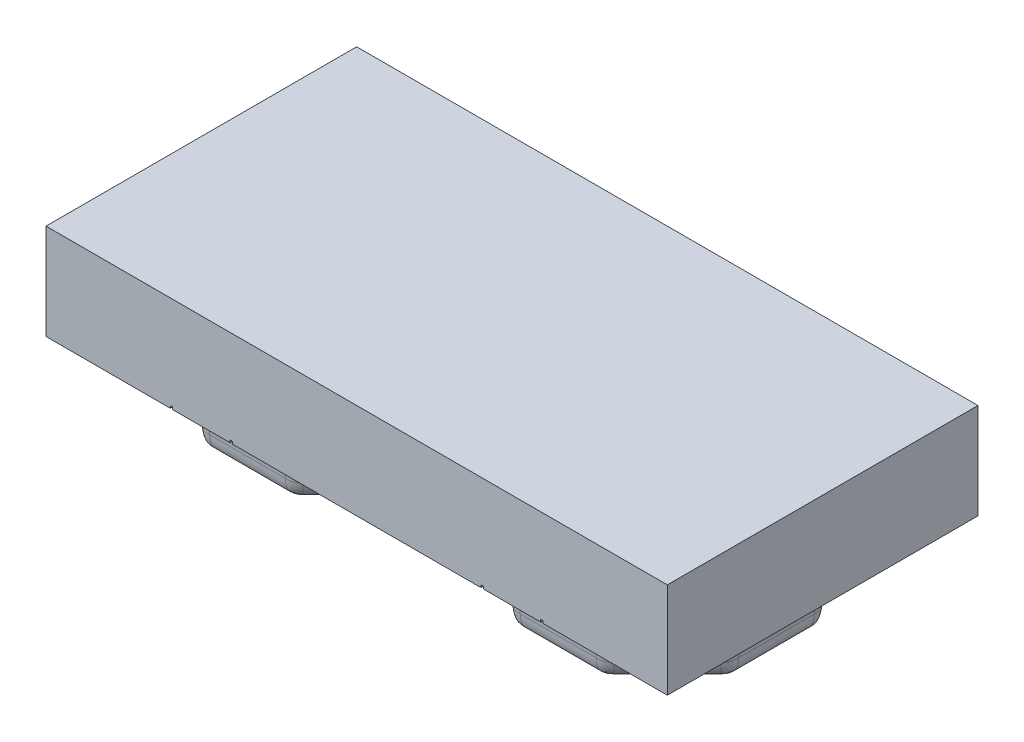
SolidWorks part; units mm, degrees
ref_plane "Front Plane" through (0, 0, 0) normal (0, 0, 1) x (1, 0, 0)
ref_plane "Top Plane" through (0, 0, 0) normal (0, 1, 0) x (1, 0, 0)
ref_plane "Right Plane" through (0, 0, 0) normal (1, 0, 0) x (0, 0, -1)
imported_body "Stock-04_02BowlTEST-1"
sketch "Sketch1" plane through (0, 0, -65) normal (0, 0, -1) x (-1, 0, 0)
  line L5 (-16.5764, 0) -> (16.5765, 0) construction
  line L6 (13, 0) -> (12, 0)
  line L7 (13, 0) -> (13, 1)
  line L8 (13, 1) -> (12, 1)
  line L9 (12, 0) -> (12, 1)
  line L11 (-13, 0) -> (-12, 0)
  line L12 (-13, 0) -> (-13, 1)
  line L13 (-13, 1) -> (-12, 1)
  line L14 (-12, 0) -> (-12, 1)
  dimension "D1" = 12
  dimension "D2" = 12
  dimension "D3" = 1
sketch "Sketch2" plane through (0, 0, 65) normal (0, 0, 1) x (1, 0, 0)
  line L4 (12, 0) -> (13, 0)
  line L5 (12, 1) -> (12, 0)
  line L6 (13, 1) -> (12, 1)
  line L7 (13, 0) -> (13, 1)
  line L8 (12, 0) -> (13, 0)
  line L9 (12, 1) -> (12, 0)
  line L10 (13, 1) -> (12, 1)
  line L11 (13, 0) -> (13, 1)
  line L12 (-13, 0) -> (-12, 0)
  line L13 (-12, 0) -> (-12, 1)
  line L14 (-12, 1) -> (-13, 1)
  line L15 (-13, 1) -> (-13, 0)
  line L16 (-13, 0) -> (-12, 0)
  line L17 (-12, 0) -> (-12, 1)
  line L18 (-12, 1) -> (-13, 1)
  line L19 (-13, 1) -> (-13, 0)
  dimension "D1" = 0
  dimension "D2" = 0
extrude "Cut-Extrude1" cut sketch "Sketch1" against normal up to surface (17.5095 mm away)
extrude "Cut-Extrude2" cut sketch "Sketch2" against normal up to surface (17.5095 mm away)
mirror "Mirror1" about plane through (65, 40, 65) normal (-1, 0, 0)
sketch "Sketch3" plane through (0, 0, 0) normal (0, 1, 0) x (1, 0, 0)
  line L0 (195, 65) -> (171.2509, 65) construction
  line L1 (185, 55) -> (175, 55)
  line L2 (185, 55) -> (185, 45)
  line L3 (185, 45) -> (175, 45)
  line L4 (175, 55) -> (175, 45)
  line L5 (195, 41.3744) -> (195, 65) construction
  line L6 (-65, 16.709) -> (-65, 41.3744) construction
  line L7 (185, -45) -> (175, -45)
  line L8 (185, -45) -> (185, -55)
  line L9 (185, -55) -> (175, -55)
  line L10 (175, -45) -> (175, -55)
  line L11 (-55, -55) -> (-45, -55)
  line L12 (-55, -55) -> (-55, -45)
  line L13 (-55, -45) -> (-45, -45)
  line L14 (-45, -55) -> (-45, -45)
  line L15 (-55, 45) -> (-45, 45)
  line L16 (-55, 45) -> (-55, 55)
  line L17 (-55, 55) -> (-45, 55)
  line L18 (-45, 45) -> (-45, 55)
  line L19 (185, 55) -> (-55, 55) construction
  line L20 (185, 55) -> (185, -55)
  line L21 (185, -55) -> (-55, -55)
  line L22 (-55, 55) -> (-55, -55)
  line L23 (70, 55) -> (60, 55)
  line L24 (70, 55) -> (70, 45)
  line L25 (70, 45) -> (60, 45)
  line L26 (60, 55) -> (60, 45)
  line L27 (60, -55) -> (70, -55)
  line L28 (60, -55) -> (60, -45)
  line L29 (60, -45) -> (70, -45)
  line L30 (70, -55) -> (70, -45)
  line L31 (-16.709, -65) -> (-41.3744, -65) construction
  line L32 (65, 55) -> (65, -55) construction
  point P34 (65, -45)
  point P35 (65, 55)
  dimension "D1" = 10
  dimension "D2" = 10
  dimension "D3" = 10
  dimension "D4" = 10
  dimension "D5" = 10
  dimension "D6" = 10
  dimension "D7" = 10
  dimension "D8" = 10
  dimension "D9" = 10
  dimension "D10" = 10
extrude "Boss-Extrude1" add sketch "Sketch3" against normal blind 10 draft 3 contours L1 L4 L3 L2 | L7 L10 L9 L8 | L21 L30 L29 L28 | L23 L26 L25 L24 | L15 L18 L17 L16 | L11 L14 L13 L12
